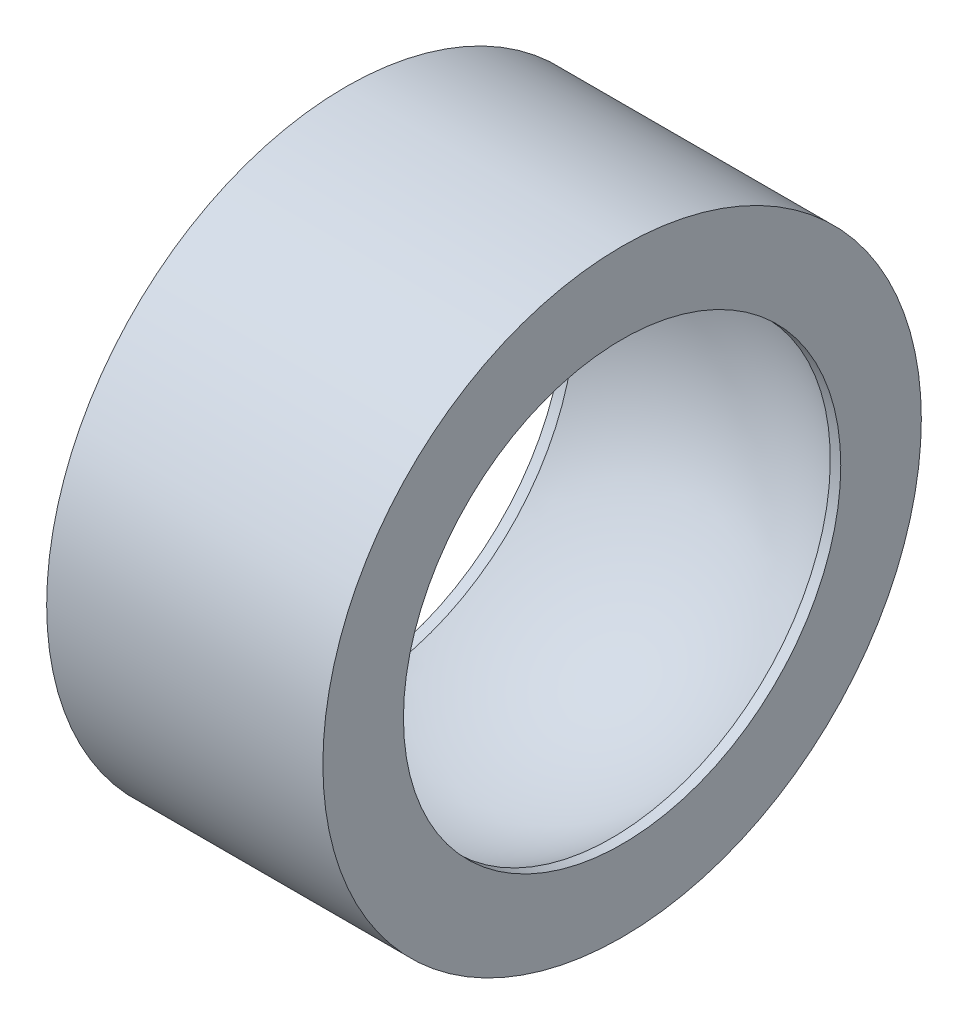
SolidWorks part; units mm, degrees
ref_plane "Plan1" through (0, 0, 0) normal (0, 0, 1) x (1, 0, 0)
ref_plane "Plan2" through (0, 0, 0) normal (0, 1, 0) x (1, 0, 0)
ref_plane "Plan3" through (0, 0, 0) normal (1, 0, 0) x (0, 0, -1)
sketch "Esquisse1" plane through (0, 0, 0) normal (0, 0, 1) x (1, 0, 0)
  line L0 (11.5453, 9.5) -> (12, 9.5)
  line L1 (0, 13) -> (12, 13)
  line L2 (0, 13) -> (0, 9.5)
  line L3 (0, 9.5) -> (0.4547, 9.5)
  line L4 (12, 13) -> (12, 9.5)
  line L5 (0, 0) -> (20, 0) construction
  arc A0 (11.5453, 9.5) -> (0.4547, 9.5) centre (6, 0) ccw
  point P7 (6, 13)
  dimension "D3" = 22
  dimension "D1" = 13
  dimension "D2" = 12
  dimension "D4" = 3.5
revolve "Base-Révolution" add sketch "Esquisse1" angle 360 about L5
